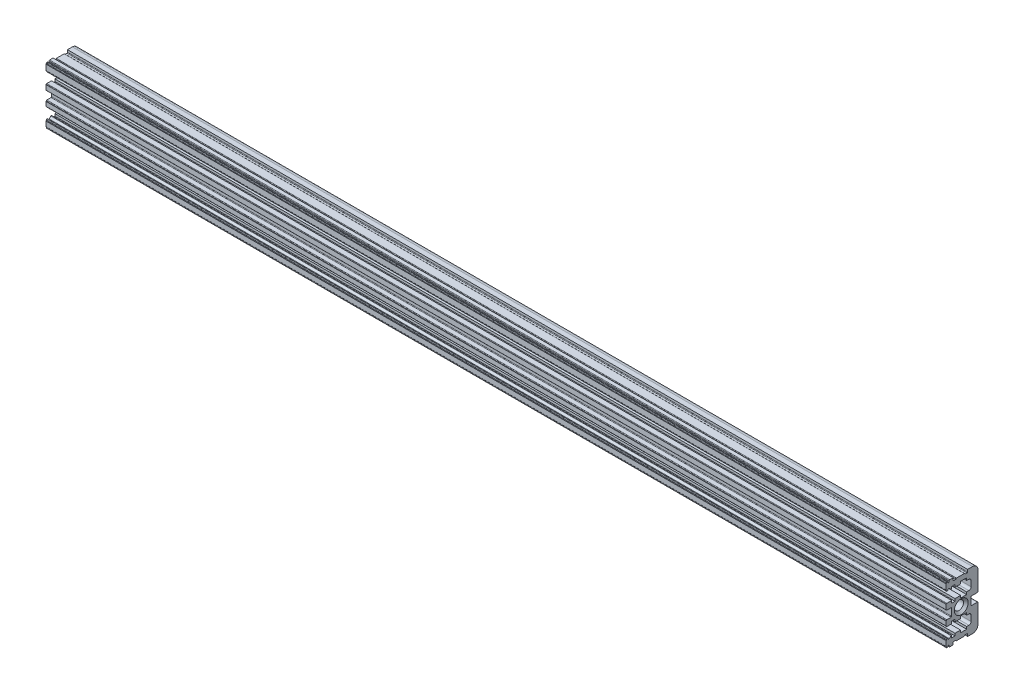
SolidWorks part; units mm, degrees
other "1"
ref_plane "前视基准面" through (0, 0, 0) normal (0, 0, 1) x (1, 0, 0)
ref_plane "上视基准面" through (0, 0, 0) normal (0, 1, 0) x (1, 0, 0)
ref_plane "右视基准面" through (0, 0, 0) normal (1, 0, 0) x (0, 0, -1)
imported_body "输入1"
sketch "草图1" plane through (0, 0, 8.75) normal (0, 0, -1) x (-1, 0, 0)
  line L0 (-215.9, -1.4) -> (-215.9, -8.2) construction
  line L1 (215.9, -37.1242) -> (109.22, -37.1242)
  line L2 (215.9, -37.1242) -> (215.9, 45.6551)
  line L3 (215.9, 45.6551) -> (109.22, 45.6551)
  line L4 (109.22, -37.1242) -> (109.22, 45.6551)
  line L5 (215.9, -1.4) -> (215.9, -8.2) construction
  point P4 (-215.9, -4.8)
  dimension "D1" = 325.12
extrude "切除-拉伸1" cut sketch "草图1" against normal through all
sketch "草图2" plane through (-109.22, 0, 0) normal (-1, 0, 0) x (0, 0, 1)
  circle A0 centre (14.8, -9.9) radius 1.65
extrude "切除-拉伸2" cut sketch "草图2" against normal blind 15.02
chamfer "倒角1" distance 0.85 angle 45 1 edges at (-109.22, -9.9, 16.45)
